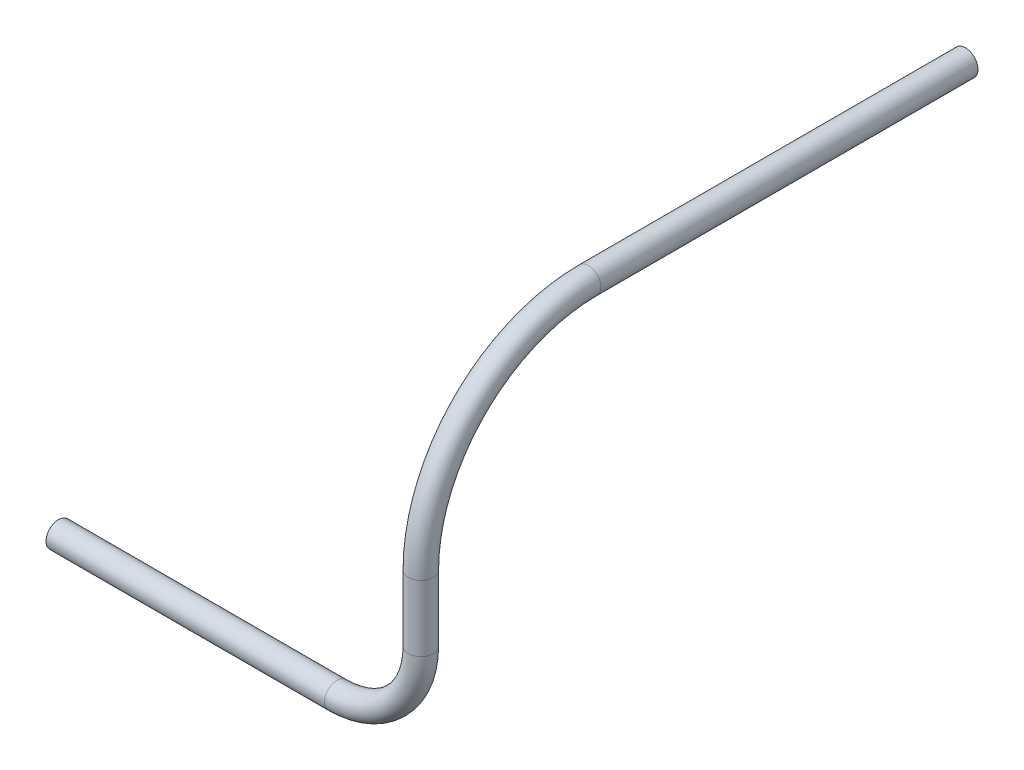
SolidWorks part; units mm, degrees
ref_plane "Front Plane" through (0, 0, 0) normal (0, 0, 1) x (1, 0, 0)
ref_plane "Top Plane" through (0, 0, 0) normal (0, 1, 0) x (1, 0, 0)
ref_plane "Right Plane" through (0, 0, 0) normal (1, 0, 0) x (0, 0, -1)
sketch "Sketch1" plane through (0, 0, 0) normal (0, 0, 1) x (1, 0, 0)
  circle A0 centre (-38.1, 12.7) radius 3.81 construction
  circle A1 centre (-38.1, 12.7) radius 3.81
ref_plane "Plane1" through (-38.1, 0, 0) normal (1, 0, 0) x (0, 0, -1)
sketch "Sketch2" plane through (-38.1, 0, 0) normal (1, 0, 0) x (0, 0, -1)
  line L0 (0, 12.7) -> (-114.3, 12.7)
  line L1 (0, 16.51) -> (0, 8.89) construction
  line L2 (-165.1, -83.5025) -> (-165.1, -38.1) construction
  arc A0 (-114.3, 12.7) -> (-165.1, -38.1) centre (-114.3, -38.1) ccw
  dimension "D1" = 50.8
  dimension "D2" = 114.3
sweep "Sweep1" add profiles "Sketch1" path "Sketch2"
sketch "Sketch6" plane through (0, 0, 165.1) normal (0, 0, -1) x (-1, 0, 0)
  line L0 (38.1, -38.1) -> (38.1, -58.1025)
  line L1 (63.5, -83.5025) -> (88.9, -83.5025)
  line L2 (88.9, -83.5025) -> (147.9137, -83.5025)
  arc A0 (38.1, -58.1025) -> (63.5, -83.5025) centre (63.5, -58.1025) ccw
  dimension "D1" = 25.4
sketch "Sketch7" plane through (0, -38.1, 0) normal (0, -1, 0) x (1, 0, 0)
  circle A0 centre (-38.1, 165.1) radius 3.81 construction
  circle A1 centre (-38.1, 165.1) radius 3.81
sweep "Sweep2" add profiles "Sketch7" path "Sketch6"
